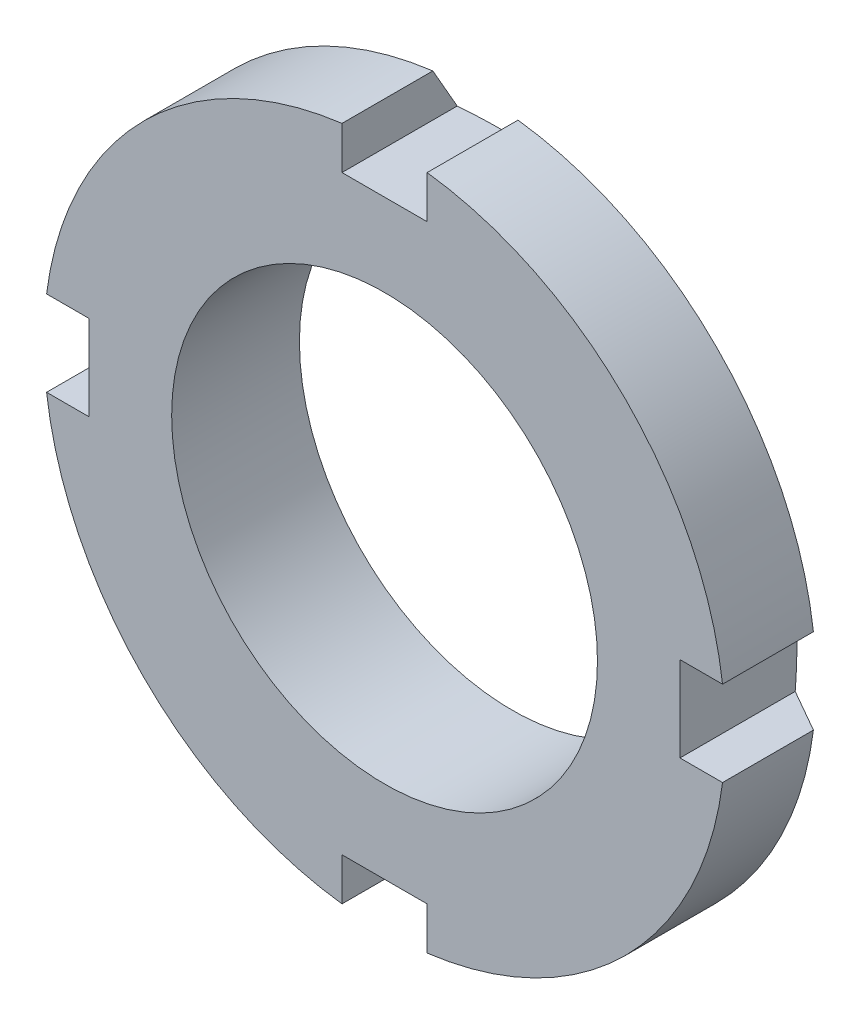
SolidWorks part; units mm, degrees
ref_plane "Face" through (0, 0, 0) normal (0, 0, 1) x (1, 0, 0)
ref_plane "Dessus" through (0, 0, 0) normal (0, 1, 0) x (1, 0, 0)
ref_plane "Droite" through (0, 0, 0) normal (1, 0, 0) x (0, 0, -1)
sketch "Esquisse1" plane through (0, 0, 0) normal (1, 0, 0) x (0, 0, -1)
  line L0 (0, 0) -> (-2, 0) construction
  line L1 (0, 10) -> (0, 13)
  line L2 (0, 13) -> (-1.7321, 16)
  line L3 (-1.7321, 16) -> (-6, 16)
  line L4 (-6, 16) -> (-6, 10)
  line L5 (-6, 10) -> (0, 10)
  line L6 (0, 10) -> (0, -10) construction
  dimension "D2" = 30
  dimension "h" = 6
  dimension "dn" = 20
  dimension "D" = 32
  dimension "d1" = 26
revolve "Base-Révolution" add sketch "Esquisse1" angle 360 about L0
sketch "Esquisse2" plane through (0, 0, 0) normal (0, 0, 1) x (1, 0, 0)
  line L0 (0, 0) -> (0, 13.8745) construction
  line L1 (0, 0) -> (13.8745, 0) construction
  line L2 (-2, 13.8745) -> (2, 13.8745)
  line L3 (13.8745, 2) -> (13.8745, -2)
  line L4 (2, 13.8745) -> (2, 15.8745)
  line L5 (-2, 13.8745) -> (-2, 15.8745)
  line L6 (13.8745, 2) -> (15.8745, 2)
  line L7 (13.8745, -2) -> (15.8745, -2)
  line L8 (-13.8745, -2) -> (-15.8745, -2)
  line L9 (-13.8745, 2) -> (-15.8745, 2)
  line L10 (-13.8745, 2) -> (-13.8745, -2)
  line L11 (-2, -13.8745) -> (-2, -15.8745)
  line L12 (2, -13.8745) -> (2, -15.8745)
  line L13 (-2, -13.8745) -> (2, -13.8745)
  circle A0 centre (0, 0) radius 16 construction
  arc A1 (15.8745, 2) -> (2, 15.8745) centre (0, 0) ccw
  arc A2 (-2, 15.8745) -> (-15.8745, 2) centre (0, 0) ccw
  arc A3 (-15.8745, -2) -> (-2, -15.8745) centre (0, 0) ccw
  arc A4 (2, -15.8745) -> (15.8745, -2) centre (0, 0) ccw
  dimension "g" = 4
  dimension "f" = 2
extrude "Enlèv. mat.-Extru.2" cut sketch "Esquisse2" along normal through all flip side to cut
